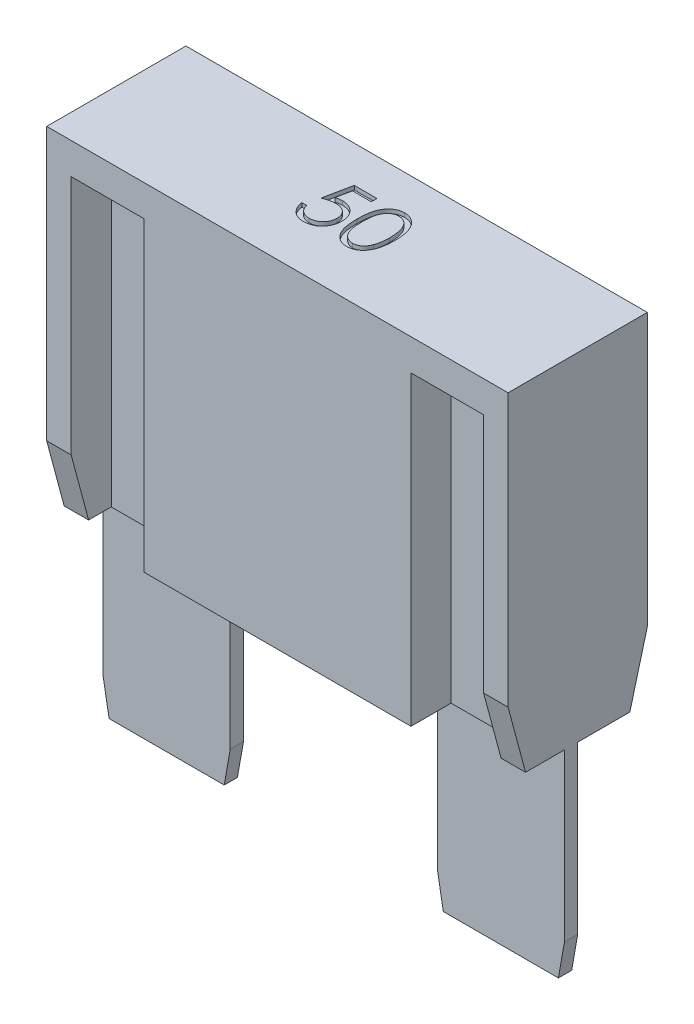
SolidWorks part; units mm, degrees
ref_plane "Front Plane" through (0, 0, 0) normal (0, 0, 1) x (1, 0, 0)
ref_plane "Top Plane" through (0, 0, 0) normal (0, 1, 0) x (1, 0, 0)
ref_plane "Right Plane" through (0, 0, 0) normal (1, 0, 0) x (0, 0, -1)
sketch "Sketch1" plane through (0, 0, 0) normal (0, 0, 1) x (1, 0, 0)
  line L1 (-14.605, 10.6807) -> (14.605, 10.6807)
  line L2 (-14.605, 10.6807) -> (-14.605, -10.6807)
  line L3 (-14.605, -10.6807) -> (14.605, -10.6807)
  line L4 (14.605, 10.6807) -> (14.605, -10.6807)
  line L5 (-14.605, 10.6807) -> (14.605, -10.6807) construction
  line L6 (-14.605, -10.6807) -> (14.605, 10.6807) construction
  point P0 (0, 0)
  dimension "D1" = 29.21
  dimension "D2" = 21.3614
extrude "Boss-Extrude1" add sketch "Sketch1" along normal mid plane 8.8138
sketch "Sketch2" plane through (0, 0, 4.4069) normal (0, 0, 1) x (1, 0, 0)
  line L0 (0, 12.8075) -> (0, -15.0484) construction
  line L1 (-14.605, -10.6807) -> (14.605, -10.6807) construction
  line L2 (-13.0556, -10.6807) -> (-8.4582, -10.6807)
  line L3 (-13.0556, -10.6807) -> (-13.0556, 8.6991)
  line L4 (-13.0556, 8.6991) -> (-8.4582, 8.6991)
  line L5 (-8.4582, -10.6807) -> (-8.4582, 8.6991)
  line L6 (-14.605, 10.6807) -> (-14.605, -10.6807) construction
  dimension "D1" = 1.5494
  dimension "D2" = 4.5974
extrude "Cut-Extrude1" cut sketch "Sketch2" against normal blind 2.54
mirror "Mirror1" about plane through (0, 0, 0) normal (1, 0, 0) of "Cut-Extrude1"
mirror "Mirror2" about plane through (0, 0, 0) normal (0, 0, 1) of "Mirror1", "Cut-Extrude1"
sketch "Sketch3" plane through (0, 10.6807, 0) normal (0, 1, 0) x (1, 0, 0)
  text T0 "50"
sketch "Sketch4" plane through (-14.605, 0, 0) normal (-1, 0, 0) x (0, 0, 1)
  line L0 (-3.302, -10.6807) -> (-4.4069, -6.5572)
  line L1 (4.4069, -10.6807) -> (-4.4069, -10.6807) construction
  line L2 (-4.4069, 10.6807) -> (-4.4069, -10.6807) construction
  line L3 (3.302, -10.6807) -> (4.4069, -6.5572)
  line L5 (0, -10.6807) -> (0, -3.9273) construction
  line L6 (-4.4069, -6.5572) -> (-7.8366, -6.5572)
  line L7 (-7.8366, -6.5572) -> (-7.8366, -10.6807)
  line L8 (-7.8366, -10.6807) -> (-3.302, -10.6807)
  line L9 (4.4069, -6.5572) -> (6.9983, -6.5572)
  line L10 (6.9983, -6.5572) -> (6.9983, -10.6807)
  line L11 (6.9983, -10.6807) -> (3.302, -10.6807)
  point P10 (0, -10.6807)
  dimension "D1" = 75
  dimension "D2" = 3.302
extrude "Cut-Extrude2" cut sketch "Sketch4" against normal up to next
mirror "Mirror5" about plane through (0, 0, 0) normal (1, 0, 0) of "Cut-Extrude2"
sketch "Sketch6" plane through (0, 0, 0) normal (0, 0, 1) x (1, 0, 0)
  line L0 (-13.0556, -10.6807) -> (-14.605, -10.6807) construction
  line L1 (-14.605, -10.6807) -> (-6.5532, -10.6807)
  line L2 (-14.605, -10.6807) -> (-14.605, -21.2171)
  line L3 (-14.2235, -23.3807) -> (-6.9347, -23.3807)
  line L4 (-6.5532, -10.6807) -> (-6.5532, -21.2171)
  line L5 (-14.605, -21.2171) -> (-14.2235, -23.3807)
  line L6 (-14.605, -6.5572) -> (-14.605, -10.6807) construction
  line L7 (-10.5791, -26.784) -> (-10.5791, -7.1374) construction
  line L8 (-6.5532, -21.2171) -> (-6.9347, -23.3807)
  line L9 (0, 0) -> (0, -33.5815) construction
  line L10 (6.5532, -21.2171) -> (6.9347, -23.3807)
  line L11 (14.605, -21.2171) -> (14.2235, -23.3807)
  line L12 (6.5532, -10.6807) -> (6.5532, -21.2171)
  line L13 (14.2235, -23.3807) -> (6.9347, -23.3807)
  line L14 (14.605, -10.6807) -> (14.605, -21.2171)
  line L15 (14.605, -10.6807) -> (6.5532, -10.6807)
  dimension "D1" = 8.0518
  dimension "D2" = 12.7
  dimension "D3" = 100
  dimension "D4" = 3.6444
extrude "Boss-Extrude2" add sketch "Sketch6" along normal blind 0.8382
extrude "Cut-Extrude3" cut sketch "Sketch3" against normal blind 0.254
